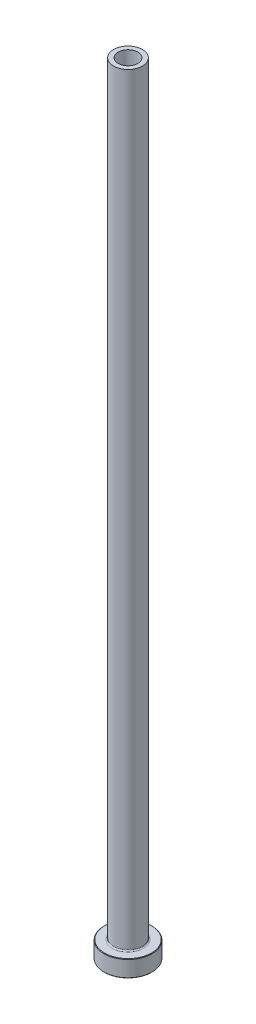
SolidWorks part; units mm, degrees
ref_plane "Front Plane" through (0, 0, 0) normal (0, 0, 1) x (1, 0, 0)
ref_plane "Top Plane" through (0, 0, 0) normal (0, 1, 0) x (1, 0, 0)
ref_plane "Right Plane" through (0, 0, 0) normal (1, 0, 0) x (0, 0, -1)
sketch "Sketch1" plane through (0, 0, 0) normal (0, 0, 1) x (1, 0, 0)
  line L0 (-4.1, 325) -> (-6, 325)
  line L1 (-6, 325) -> (-6, 7)
  line L2 (-6, 7) -> (-10, 7)
  line L3 (-10, 7) -> (-10, 0)
  line L4 (11, 0) -> (-11, 0) construction
  line L5 (-10, 0) -> (-4.35, 0)
  line L6 (-4.1, 280) -> (-4.1, 325)
  line L7 (0, 92.1877) -> (0, -15.5353) construction
  line L8 (0, -11) -> (0, 11) construction
  line L9 (-4.1, 280) -> (-4.35, 268)
  line L10 (-4.35, 268) -> (-4.35, 0)
  dimension "D1" = 0.25
  dimension "ID" = 8.2
  dimension "OD" = 12
  dimension "L" = 325
  dimension "H" = 20
  dimension "T" = 7
  dimension "N" = 45
  dimension "D2" = 12
revolve "Revolve1" add sketch "Sketch1" angle 360 about L7
fillet "Fillet1" radius 0.5 1 edges at (0, 7, 6)
chamfer "Chamfer1" distance 0.2 angle 45 2 edges at (0, 7, 10) (0, 0, 10)
chamfer "Chamfer3" distance 0.5 angle 45 1 edges at (0, 0, 4.35)
